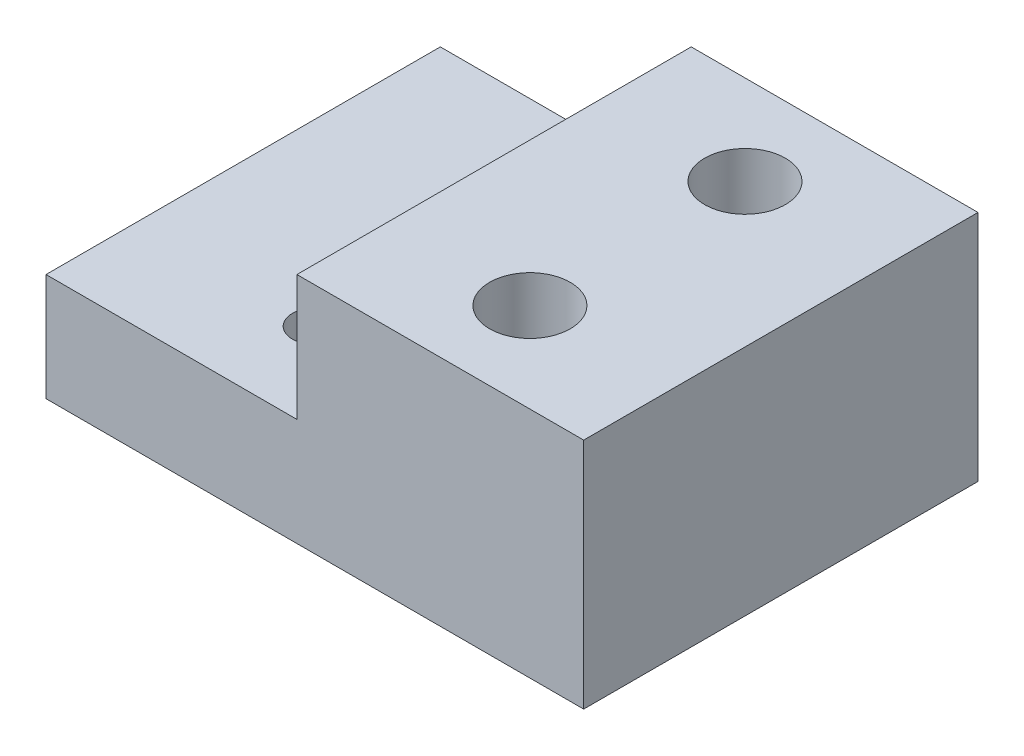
SolidWorks part; units mm, degrees
ref_plane "Спереди" through (0, 0, 0) normal (0, 0, 1) x (1, 0, 0)
ref_plane "Сверху" through (0, 0, 0) normal (0, 1, 0) x (1, 0, 0)
ref_plane "Справа" through (0, 0, 0) normal (1, 0, 0) x (0, 0, -1)
sketch "Эскиз1" plane through (0, 0, 0) normal (0, 0, 1) x (1, 0, 0)
  line L0 (-30, 0) -> (0, 0)
  line L1 (0, 0) -> (0, 13)
  line L2 (0, 13) -> (-16, 13)
  line L3 (-16, 13) -> (-16, 6)
  line L4 (-16, 6) -> (-30, 6)
  line L5 (-30, 6) -> (-30, 0)
  dimension "D1" = 13
  dimension "D2" = 6
  dimension "D3" = 30
  dimension "D4" = 16
extrude "Бобышка-Вытянуть1" add sketch "Эскиз1" against normal blind 22
hole_wizard "Отверстие обработанное метчиком M31" positions "Эскиз3" profile "Эскиз2" tap size "M3" standard "DIN"
sketch "Эскиз3" plane through (0, 6, 0) normal (0, 1, 0) x (1, 0, 0)
  line L0 (-30, 11) -> (2.1614, 11) construction
  line L1 (-30, 22) -> (-30, 0) construction
  point P0 (-20, 5)
  point P2 (-20, 17)
  dimension "D1" = 12
  dimension "D2" = 10
sketch "Эскиз2" plane through (-20, 6, -5) normal (1, 0, 0) x (0, 0, 1)
  line L0 (0, 0) -> (0, 6)
  line L1 (0, 6) -> (1.25, 6)
  line L2 (1.25, 6) -> (1.25, 0)
  line L5 (1.25, 0) -> (0, 0)
  line L11 (0, -6.35) -> (0, 107.95) construction
  dimension "Диаметр проходного сверла" = 2.5
  dimension "Глубина проходного сверла" = 6
sketch "Эскиз4" plane through (0, 13, 0) normal (0, 1, 0) x (1, 0, 0)
  line L0 (-30, 11) -> (2.4729, 11) construction
  line L1 (-30, 22) -> (-30, 0) construction
  line L2 (0, 22) -> (0, 0) construction
  circle A0 centre (-8, 17) radius 2.25
  circle A1 centre (-8, 5) radius 2.25
  dimension "D1" = 12
  dimension "D2" = 4.5
  dimension "D3" = 8
extrude "Вырез-Вытянуть1" cut sketch "Эскиз4" against normal through all
sketch "Эскиз5" plane through (0, 0, 0) normal (0, -1, 0) x (1, 0, 0)
  circle A0 centre (-8, -5) radius 4
  circle A1 centre (-8, -17) radius 4
  dimension "D1" = 8
extrude "Вырез-Вытянуть2" cut sketch "Эскиз5" against normal blind 5.5
chamfer "Фаска1" distance 0.5 angle 45 2 edges at (-20, 0, -15.75) (-20, 0, -3.75)
